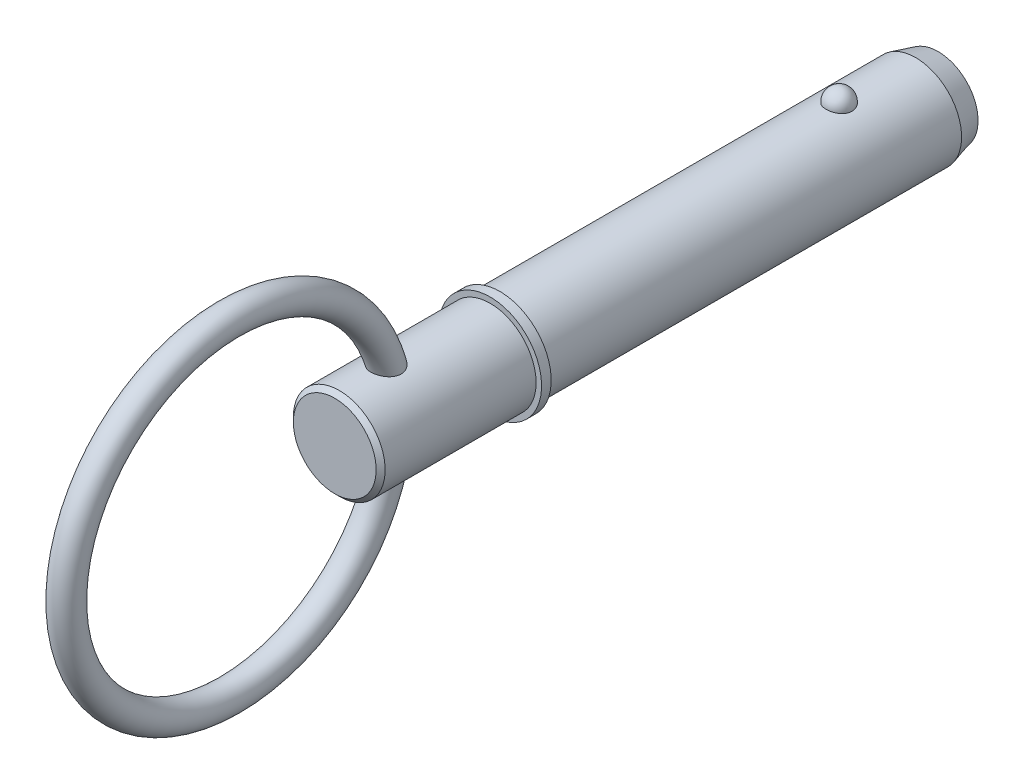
SolidWorks part; units mm, degrees
ref_plane "Front Plane" through (0, 0, 0) normal (0, 0, 1) x (1, 0, 0)
ref_plane "Top Plane" through (0, 0, 0) normal (0, 1, 0) x (1, 0, 0)
ref_plane "Right Plane" through (0, 0, 0) normal (1, 0, 0) x (0, 0, -1)
sketch "Sketch2" plane through (0, 0, 0) normal (0, 0, 1) x (1, 0, 0)
  circle A0 centre (0, 0) radius 7.145
  point P3 (0, 7.145)
  dimension "D1" = 14.29
extrude "Boss-Extrude1" add sketch "Sketch2" along normal blind 50.8
sketch "Sketch3" plane through (0, 0, 0) normal (0, 0, -1) x (-1, 0, 0)
  circle A0 centre (0, 0) radius 7.145
  dimension "D1" = 14.29
extrude "Boss-Extrude2" add sketch "Sketch3" along normal blind 17.45
chamfer "Chamfer1" distance 3.5 angle 15 1 edges at (-7.145, 0, -17.45)
sketch "Sketch18" plane through (0, 0, 0) normal (1, 0, 0) x (0, 0, -1)
  line L0 (13.95, 7.145) -> (-50.8, 7.145) construction
  line L1 (2.02, 9.165) -> (2.02, 5.125)
  line L2 (-50.8, -7.145) -> (13.95, -7.145) construction
  arc A0 (2.02, 9.165) -> (2.02, 5.125) centre (2.02, 7.145) ccw
  point P4 (0, 7.145)
  dimension "D1" = 16.31
revolve "Revolve1" add sketch "Sketch18" angle 360 about L1
sketch "Sketch19" plane through (0, 0, 0) normal (1, 0, 0) x (0, 0, -1)
  line L0 (-33.7288, 0) -> (-46.4542, 0) construction
sketch "Sketch20" plane through (0, 0, 0) normal (1, 0, 0) x (0, 0, -1)
  line L0 (-50.8, 0) -> (-50.8, 8)
  line L1 (-50.8, 7.145) -> (-50.8, -7.145) construction
  line L2 (-50.8, 8) -> (-52.3, 8)
  line L3 (-52.3, 8) -> (-52.3, 0)
  line L4 (-33.7288, 0) -> (-46.4542, 0) construction
  line L5 (-52.3, 0) -> (-50.8, 0)
  dimension "D1" = 8
  dimension "D2" = 1.5
revolve "Revolve2" add sketch "Sketch20" angle 360 about L0
sketch "Sketch21" plane through (0, 0, 50.8) normal (0, 0, -1) x (-1, 0, 0)
  circle A0 centre (0, 0) radius 7.145
  dimension "D1" = 14.29
extrude "Boss-Extrude3" add sketch "Sketch21" against normal blind 25.7
chamfer "Chamfer2" distance 0.7 angle 45 1 edges at (-7.145, 0, 76.5)
sketch "Sketch23" plane through (0, 0, 0) normal (1, 0, 0) x (0, 0, -1)
  line L0 (-76.5, 6.445) -> (-76.5, -6.445) construction
  circle A0 centre (-92.9, 0) radius 25.4
  point P2 (-67.5, 0)
  dimension "D1" = 50.8
  dimension "D2" = 9
sketch "Sketch24" plane through (0, 0, 0) normal (0, 1, 0) x (1, 0, 0)
  circle A0 centre (0, -67.5) radius 2.25
  dimension "D1" = 4.5
sweep "Sweep1" add profiles "Sketch24" path "Sketch23"
